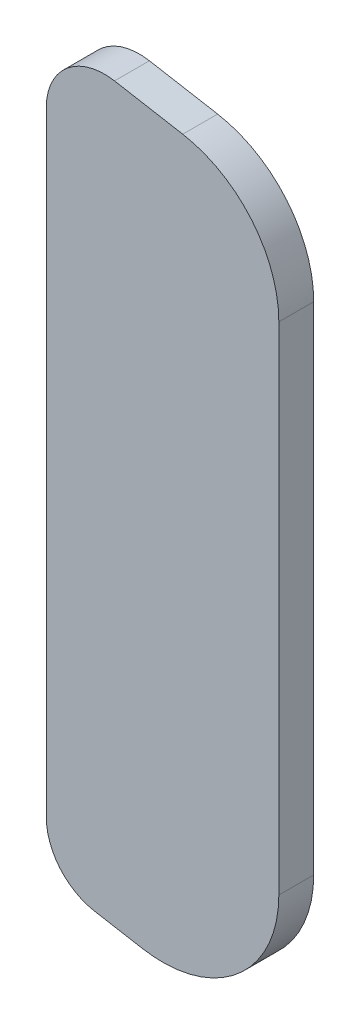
SolidWorks part; units mm, degrees
ref_plane "Face" through (0, 0, 0) normal (0, 0, 1) x (1, 0, 0)
ref_plane "Dessus" through (0, 0, 0) normal (0, 1, 0) x (1, 0, 0)
ref_plane "Droite" through (0, 0, 0) normal (1, 0, 0) x (0, 0, -1)
sketch "Esquisse1" plane through (0, 0, 0) normal (0, 0, 1) x (1, 0, 0)
  line L0 (-10.7817, 17.2702) -> (-4.9134, 16.2355)
  line L1 (3.3501, 6.3874) -> (3.3501, -36.304)
  line L2 (-8.3864, -46.1521) -> (-12.5182, -45.4236)
  line L3 (-16.6499, -40.4995) -> (-16.6499, 12.3462)
  line L4 (-16.6499, 18.305) -> (0, 18.305) construction
  arc A0 (-16.6499, 12.3462) -> (-10.7817, 17.2702) centre (-11.6499, 12.3462) cw
  arc A1 (-8.3864, -46.1521) -> (3.3501, -36.304) centre (-6.6499, -36.304) ccw
  arc A2 (-4.9134, 16.2355) -> (3.3501, 6.3874) centre (-6.6499, 6.3874) cw
  arc A3 (-12.5182, -45.4236) -> (-16.6499, -40.4995) centre (-11.6499, -40.4995) cw
  point P14 (-16.6499, -44.695)
  dimension "D4" = 5
  dimension "D5" = 10
  dimension "D6" = 10
  dimension "D7" = 5
  dimension "D1" = 20
  dimension "D2" = 63
  dimension "D3" = 10
extrude "Extrusion1" add sketch "Esquisse1" along normal blind 3
